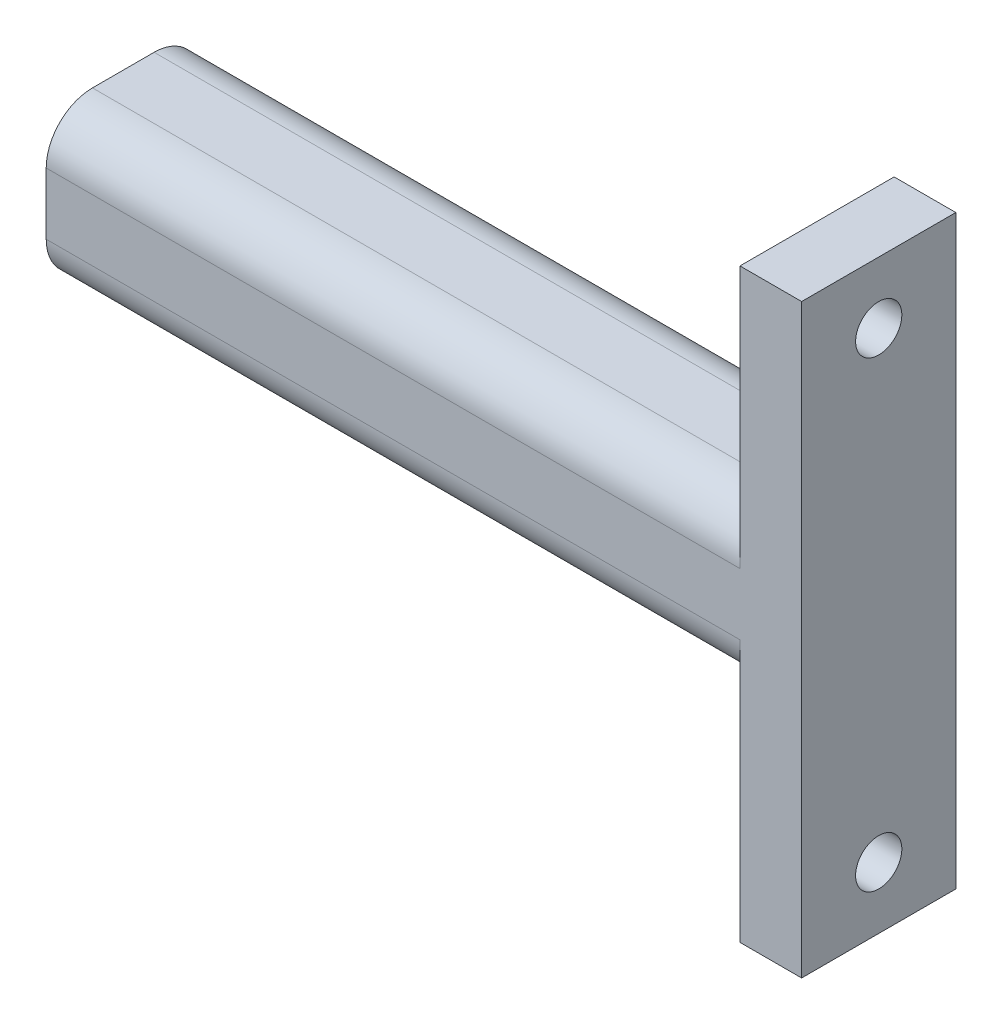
SolidWorks part; units mm, degrees
ref_plane "Front Plane" through (0, 0, 0) normal (0, 0, 1) x (1, 0, 0)
ref_plane "Top Plane" through (0, 0, 0) normal (0, 1, 0) x (1, 0, 0)
ref_plane "Right Plane" through (0, 0, 0) normal (1, 0, 0) x (0, 0, -1)
sketch "Sketch1" plane through (0, 0, 0) normal (0, 0, 1) x (1, 0, 0)
  line L4 (-17.8302, 22.0942) -> (-17.8302, 31.2194) construction
  line L26 (-40.3302, 22.0942) -> (4.6698, 22.0942)
  line L29 (4.6698, 22.0942) -> (4.6698, 36.0942)
  line L30 (4.6698, 36.0942) -> (8.6698, 36.0942)
  line L34 (8.6698, 36.0942) -> (8.6698, -1.9058)
  line L35 (4.6698, -1.9058) -> (8.6698, -1.9058)
  line L36 (4.6698, 12.0942) -> (4.6698, -1.9058)
  line L43 (-40.3302, 12.0942) -> (4.6698, 12.0942)
  line L44 (-40.3302, 22.0942) -> (-40.3302, 12.0942)
  point P12 (8.6698, 17.0942)
  dimension "D2" = 4
extrude "Boss-Extrude1" add sketch "Sketch1" along normal blind 10
sketch "Sketch7" plane through (8.6698, 0, 0) normal (1, 0, 0) x (0, 0, -1)
  line L0 (-10, 17.0942) -> (2.9892, 17.0942) construction
  line L1 (-10, -1.9058) -> (-10, 36.0942) construction
  line L2 (-5, 36.0942) -> (-5, -1.9058) construction
  line L3 (-10, 36.0942) -> (0, 36.0942) construction
  line L4 (-10, -1.9058) -> (0, -1.9058) construction
  circle A0 centre (-5, 32.0942) radius 1.5
  circle A1 centre (-5, 2.0942) radius 1.5
  dimension "D1" = 3
  dimension "D2" = 4
extrude "Cut-Extrude1" cut sketch "Sketch7" against normal blind 10
fillet "Fillet1" radius 3 4 edges at (-17.8302, 12.0942, 0) (-17.8302, 22.0942, 0) (-17.8302, 12.0942, 10) (-17.8302, 22.0942, 10)
sketch "Sketch8" plane through (-40.3302, 0, 0) normal (-1, 0, 0) x (0, 0, 1)
  circle A0 centre (5, 17.0942) radius 3
  dimension "D1" = 6
extrude "Cut-Extrude2" cut sketch "Sketch8" against normal blind 25
thread "Thread1" pitch 1.25 start angle 0, offset 0, length 25, pitch 1.25, diameter 6
ref_plane "Plane1" through (-40.3302, 17.0942, 2) normal (0, -1, 0) x (0.0523, 0, -0.9986)
sketch "Thread Profile1" plane through (-40.3302, 17.0942, 2) normal (0, -1, 0) x (0.0523, 0, -0.9986)
  line L0 (0, 0) -> (0, 1.25) construction
  line L1 (0, 0) -> (0.6766, 0.3906)
  line L2 (0.6766, 0.3906) -> (0.6766, 0.5469)
  line L3 (0.6766, 0.5469) -> (0, 0.9375)
  line L4 (0.6766, 0.4687) -> (0, 0.4687) construction
  line L11 (0, 0) -> (0, 0.9375)
  point P2 (0, 0)
  dimension "Pitch" = 1.25
  dimension "Profile_Angle" = 60
  dimension "Profile_Land" = 0.1562
  dimension "Profile_Height" = 0.6766
